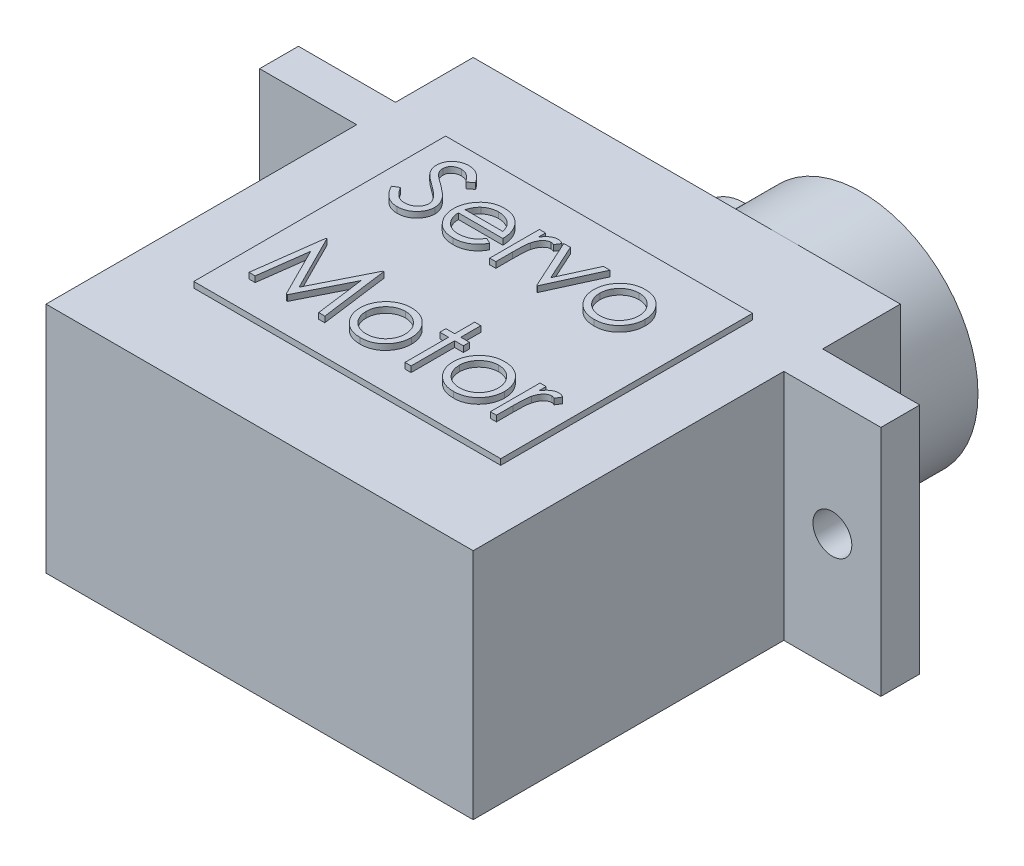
SolidWorks part; units mm, degrees
ref_plane "Front Plane" through (0, 0, 0) normal (0, 0, 1) x (1, 0, 0)
ref_plane "Top Plane" through (0, 0, 0) normal (0, 1, 0) x (1, 0, 0)
ref_plane "Right Plane" through (0, 0, 0) normal (1, 0, 0) x (0, 0, -1)
sketch "Sketch1" plane through (0, 0, 0) normal (0, 1, 0) x (1, 0, 0)
  line L0 (-11, 5) -> (-11, -11)
  line L1 (-11, 11) -> (11, 11)
  line L2 (-11, 11) -> (-11, 7)
  line L3 (-11, -11) -> (11, -11)
  line L4 (11, 11) -> (11, 7)
  line L5 (-11, 11) -> (11, -11) construction
  line L6 (-11, -11) -> (11, 11) construction
  line L7 (11, 7) -> (16, 7)
  line L9 (11, 5) -> (16, 5)
  line L10 (16, 7) -> (16, 5)
  line L11 (-11, 7) -> (-16, 7)
  line L12 (11, 5) -> (11, -11)
  line L13 (-11, 5) -> (-16, 5)
  line L14 (-16, 7) -> (-16, 5)
  point P0 (0, 0)
  dimension "D1" = 22
  dimension "D2" = 22
  dimension "D3" = 4
  dimension "D4" = 2
  dimension "D5" = 5
  dimension "D6" = 4
  dimension "D7" = 2
  dimension "D8" = 5
extrude "Boss-Extrude1" add sketch "Sketch1" along normal blind 12
sketch "Sketch2" plane through (0, 0, -11) normal (0, 0, -1) x (-1, 0, 0)
  line L0 (-11, 12) -> (-11, 0) construction
  line L1 (-11, 0) -> (11, 0) construction
  line L2 (1, 8.5) -> (0.4544, 8.5)
  line L4 (0.4544, 3.5) -> (1, 3.5)
  arc A0 (0.4544, 8.5) -> (0.4544, 3.5) centre (-5, 6) ccw
  arc A1 (1, 3.5) -> (1, 8.5) centre (1, 6) ccw
  dimension "D1" = 6
  dimension "D2" = 6
  dimension "D3" = 12
  dimension "D4" = 5
extrude "Boss-Extrude2" add sketch "Sketch2" along normal blind 4
sketch "Sketch3" plane through (0, 12, 0) normal (0, 1, 0) x (1, 0, 0)
  line L1 (-7.9041, -6.4842) -> (7.9041, -6.4842)
  line L2 (-7.9041, -6.4842) -> (-7.9041, 6.4842)
  line L3 (-7.9041, 6.4842) -> (7.9041, 6.4842)
  line L4 (7.9041, -6.4842) -> (7.9041, 6.4842)
  line L5 (-7.9041, -6.4842) -> (7.9041, 6.4842) construction
  line L6 (-7.9041, 6.4842) -> (7.9041, -6.4842) construction
  point P0 (0, 0)
extrude "Boss-Extrude3" add sketch "Sketch3" along normal blind 0.3
sketch "Sketch4" plane through (0, 12.3, 0) normal (0, 1, 0) x (1, 0, 0)
  text T0 "Servo  Motor"
extrude "Boss-Extrude4" add sketch "Sketch4" along normal blind 0.3
sketch "Sketch5" plane through (0, 0, -15) normal (0, 0, -1) x (-1, 0, 0)
  circle A0 centre (-5, 6) radius 2.5
  dimension "D1" = 5
extrude "Boss-Extrude5" add sketch "Sketch5" along normal blind 2
sketch "Sketch8" plane through (0, 0, -7) normal (0, 0, -1) x (-1, 0, 0)
  line L0 (-16, 12) -> (-11, 12) construction
  line L1 (-16, 12) -> (-16, 0) construction
  line L2 (11, 12) -> (16, 12) construction
  line L3 (16, 12) -> (16, 0) construction
  circle A0 centre (-13.5, 6) radius 1
  circle A1 centre (13.5, 6) radius 1
  dimension "D1" = 2
  dimension "D4" = 2
  dimension "D6" = 2.5
  dimension "D2" = 6
  dimension "D3" = 2.5
  dimension "D5" = 6
extrude "Cut-Extrude2" cut sketch "Sketch8" against normal up to next
